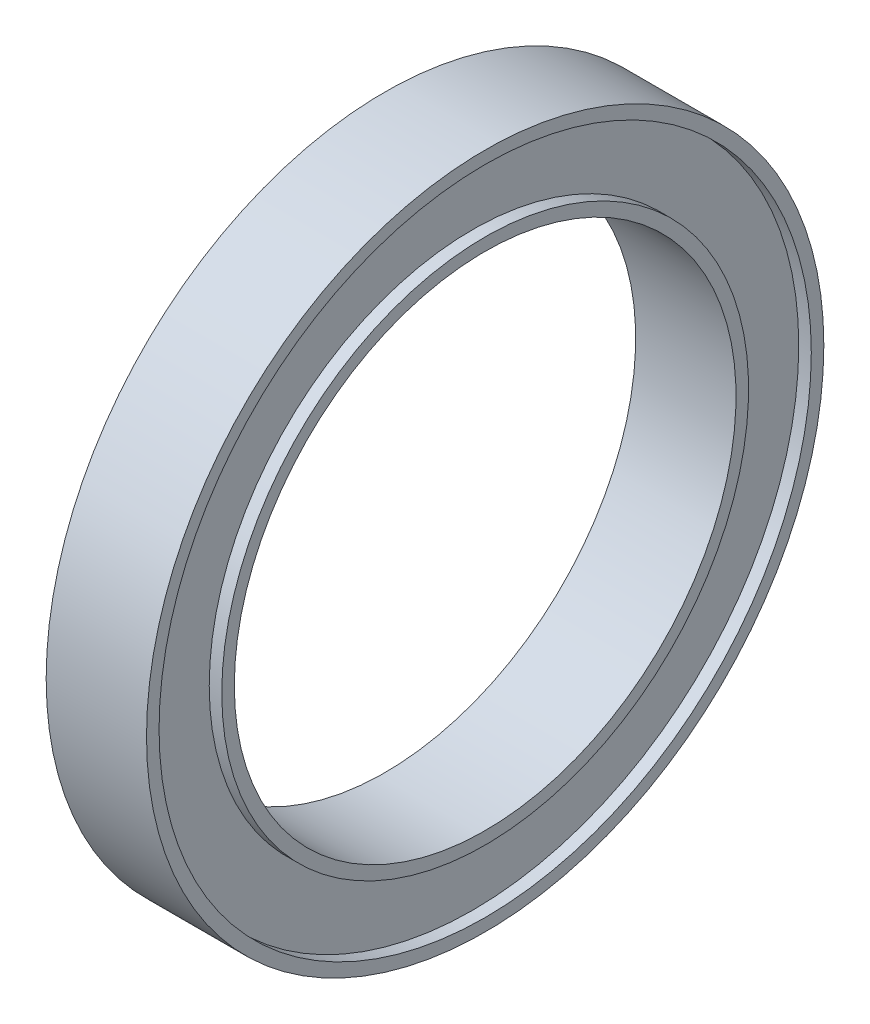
SolidWorks part; units mm, degrees
ref_plane "Front Plane" through (0, 0, 0) normal (0, 0, 1) x (1, 0, 0)
ref_plane "Top Plane" through (0, 0, 0) normal (0, 1, 0) x (1, 0, 0)
ref_plane "Right Plane" through (0, 0, 0) normal (1, 0, 0) x (0, 0, -1)
sketch "Sketch1" plane through (0, 0, 0) normal (1, 0, 0) x (0, 0, -1)
  circle A0 centre (0, 0) radius 13.5
  dimension "D1" = 27
extrude "Boss-Extrude1" add sketch "Sketch1" along normal mid plane 4
sketch "Sketch2" plane through (-2, 0, 0) normal (-1, 0, 0) x (0, 0, 1)
  circle A0 centre (0, 0) radius 10
  dimension "D1" = 20
extrude "Cut-Extrude1" cut sketch "Sketch2" against normal blind 4
sketch "Sketch3" plane through (-2, 0, 0) normal (-1, 0, 0) x (0, 0, 1)
  circle A0 centre (0, 0) radius 10.5
  circle A1 centre (0, 0) radius 13
  point P4 (0, 0)
  dimension "D1" = 21
  dimension "D2" = 26
extrude "Cut-Extrude2" cut sketch "Sketch3" against normal blind 0.5
mirror "Mirror1" about plane through (0, 0, 0) normal (1, 0, 0) of "Cut-Extrude2"
